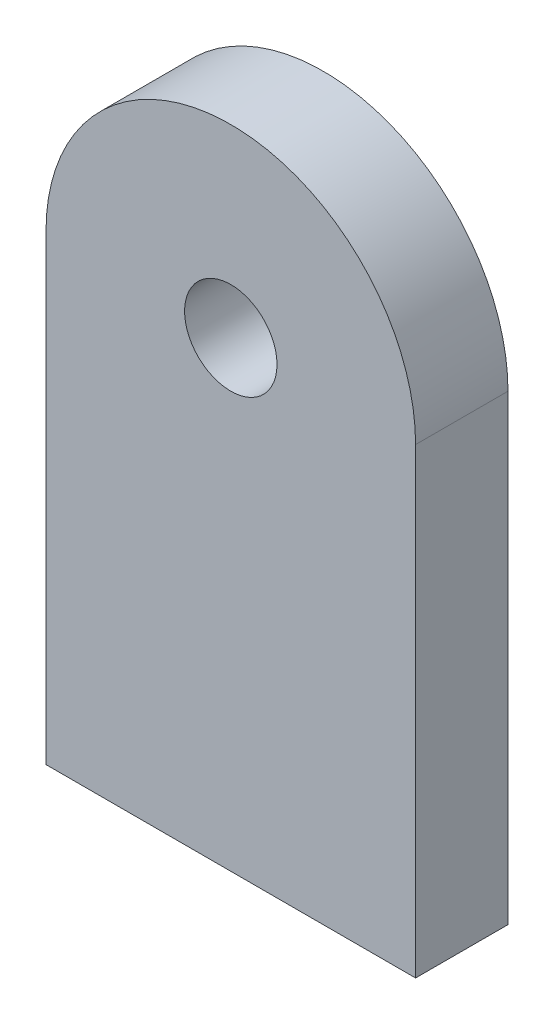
SolidWorks part; units mm, degrees
ref_plane "Front Plane" through (0, 0, 0) normal (0, 0, 1) x (1, 0, 0)
ref_plane "Top Plane" through (0, 0, 0) normal (0, 1, 0) x (1, 0, 0)
ref_plane "Right Plane" through (0, 0, 0) normal (1, 0, 0) x (0, 0, -1)
sketch "Sketch1" plane through (0, 0, 0) normal (0, 0, 1) x (1, 0, 0)
  line L0 (0, 0) -> (0, 50)
  line L1 (40, 50) -> (40, 0)
  line L2 (40, 0) -> (0, 0)
  arc A0 (0, 50) -> (40, 50) centre (20, 50) cw
  dimension "D1" = 90
  dimension "D2" = 90
  dimension "D3" = 40
  dimension "D4" = 50
  dimension "D5" = 50
extrude "Boss-Extrude1" add sketch "Sketch1" along normal blind 10
sketch "Sketch2" plane through (0, 0, 10) normal (0, 0, 1) x (1, 0, 0)
  circle A0 centre (20, 50) radius 5
  arc A1 (40, 50) -> (0, 50) centre (20, 50) ccw construction
  dimension "D1" = 10
extrude "Cut-Extrude1" cut sketch "Sketch2" against normal through all
